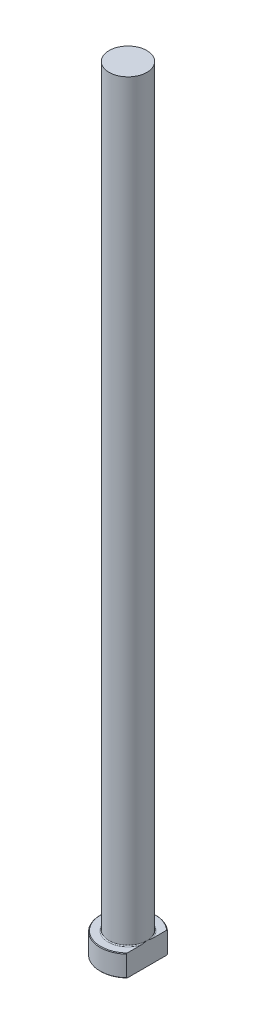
SolidWorks part; units mm, degrees
ref_plane "Front Plane" through (0, 0, 0) normal (0, 0, 1) x (1, 0, 0)
ref_plane "Top Plane" through (0, 0, 0) normal (0, 1, 0) x (1, 0, 0)
ref_plane "Right Plane" through (0, 0, 0) normal (1, 0, 0) x (0, 0, -1)
sketch "Sketch1" plane through (0, 0, 0) normal (0, 0, 1) x (1, 0, 0)
  line L0 (0, 259.9588) -> (0, -15.1925) construction
  line L1 (0, 0) -> (-9, 0)
  line L2 (-9, 0) -> (-9, 7)
  line L3 (-9, 7) -> (-6.1, 7)
  line L4 (-6.1, 7) -> (-6.1, 250)
  line L5 (-6.1, 250) -> (0, 250)
  line L6 (0, 250) -> (0, 0)
  dimension "L" = 250
  dimension "H" = 18
  dimension "T" = 7
  dimension "D" = 12.2
revolve "Revolve1" add sketch "Sketch1" angle 360 about L0
chamfer "Chamfer1" distance 0.2 angle 45 2 edges at (0, 7, 9) (0, 0, 9)
fillet "Fillet1" radius 0.3 1 edges at (0, 7, 6.1)
sketch "Sketch2" plane through (0, 0, 0) normal (0, 1, 0) x (1, 0, 0)
  line L0 (6.1, 6.6174) -> (6.1, -6.6174)
  circle A0 centre (0, 0) radius 9 construction
  arc A1 (6.1, -6.6174) -> (6.1, 6.6174) centre (0, 0) ccw
  circle A2 centre (0, 0) radius 6.1 construction
extrude "KEY" cut sketch "Sketch2" along normal through all
